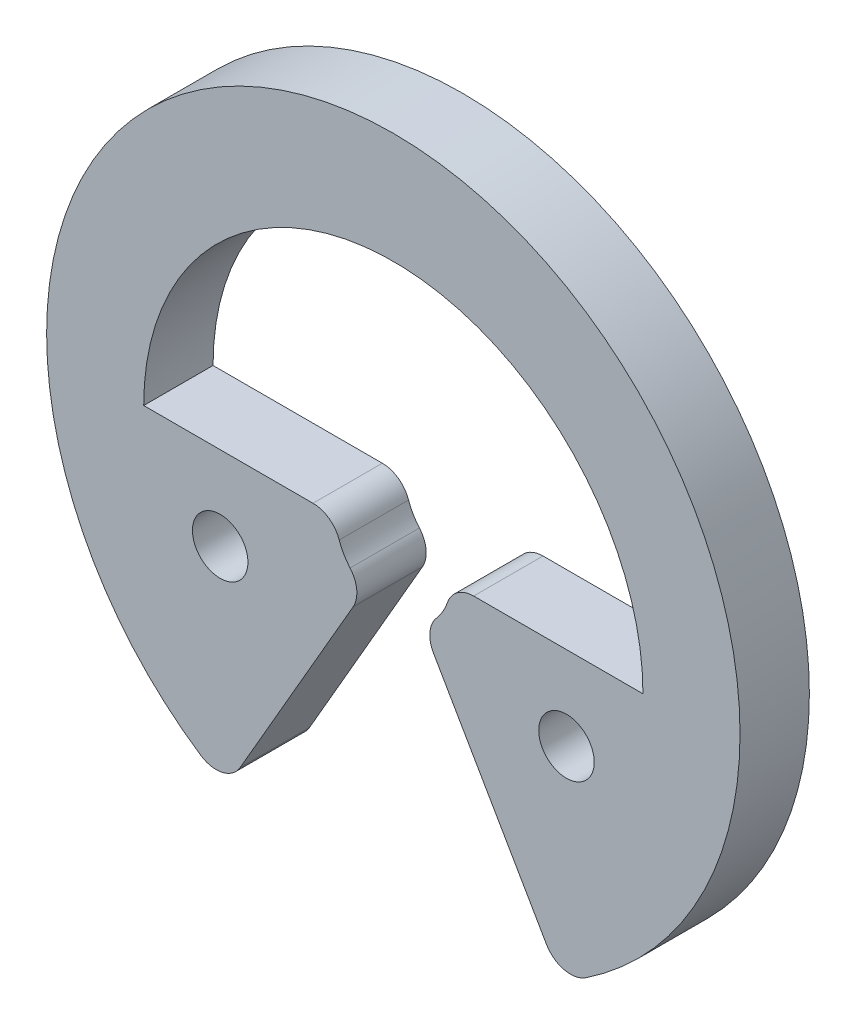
SolidWorks part; units mm, degrees
ref_plane "Plan1" through (0, 0, 0) normal (0, 0, 1) x (1, 0, 0)
ref_plane "Plan2" through (0, 0, 0) normal (0, 1, 0) x (1, 0, 0)
ref_plane "Plan3" through (0, 0, 0) normal (1, 0, 0) x (0, 0, -1)
sketch "Esquisse1" plane through (0, 0, 0) normal (0, 0, 1) x (1, 0, 0)
  line L0 (-0.9, 1.5588) -> (3.985, -6.9022) construction
  line L1 (0, 0) -> (0, -67.082) construction
  line L2 (1.1043, -1.9126) -> (0.2897, -0.5017)
  line L3 (0, 0) -> (9.8995, 0) construction
  line L4 (0.5793, 0) -> (1.8, 0)
  line L5 (-1.1043, -1.9126) -> (-0.2897, -0.5017)
  line L6 (-0.5793, 0) -> (-1.8, 0)
  line L7 (0, 0) -> (0, 1.8) construction
  line L8 (0, 1.8) -> (0, 2.6) construction
  line L9 (-0.697, -1.2072) -> (-1.8, 0) construction
  arc A0 (1.8, 0) -> (-1.8, 0) centre (0, 0) ccw
  arc A1 (-0.3903, -0.1347) -> (-0.3118, -0.2706) centre (0, 0) ccw
  arc A2 (1.3885, -1.9789) -> (-1.3885, -1.9789) centre (0, 0.1) ccw
  arc A4 (0.3118, -0.2706) -> (0.3903, -0.1347) centre (0, 0) ccw
  arc A5 (0.3903, -0.1347) -> (0.5793, 0) centre (0.5793, -0.2) cw
  arc A6 (0.2897, -0.5017) -> (0.3118, -0.2706) centre (0.4629, -0.4017) cw
  arc A7 (-0.2897, -0.5017) -> (-0.3118, -0.2706) centre (-0.4629, -0.4017) ccw
  arc A8 (-0.5793, 0) -> (-0.3903, -0.1347) centre (-0.5793, -0.2) cw
  arc A9 (-1.3885, -1.9789) -> (-1.1043, -1.9126) centre (-1.2775, -1.8126) ccw
  arc A10 (1.3885, -1.9789) -> (1.1043, -1.9126) centre (1.2775, -1.8126) cw
  circle A11 centre (-1.2485, -0.6036) radius 0.2
  circle A12 centre (1.2485, -0.6036) radius 0.2
  point P19 (0.4129, 0)
  point P22 (0.2064, -0.3576)
  point P25 (-0.2064, -0.3576)
  point P30 (-0.4129, 0)
  point P33 (-1.2064, -2.0896)
  point P36 (1.2064, -2.0896)
extrude "Base-Extrusion" add sketch "Esquisse1" along normal blind 0.5
equation "\"D5@Esquisse1\"=\"a@Esquisse1\"*2"
equation "\"D6@Esquisse1\"=\"D7@Esquisse1\"/2"
equation "\"D4@Esquisse1\" = \"D6@Esquisse1\"/2"
